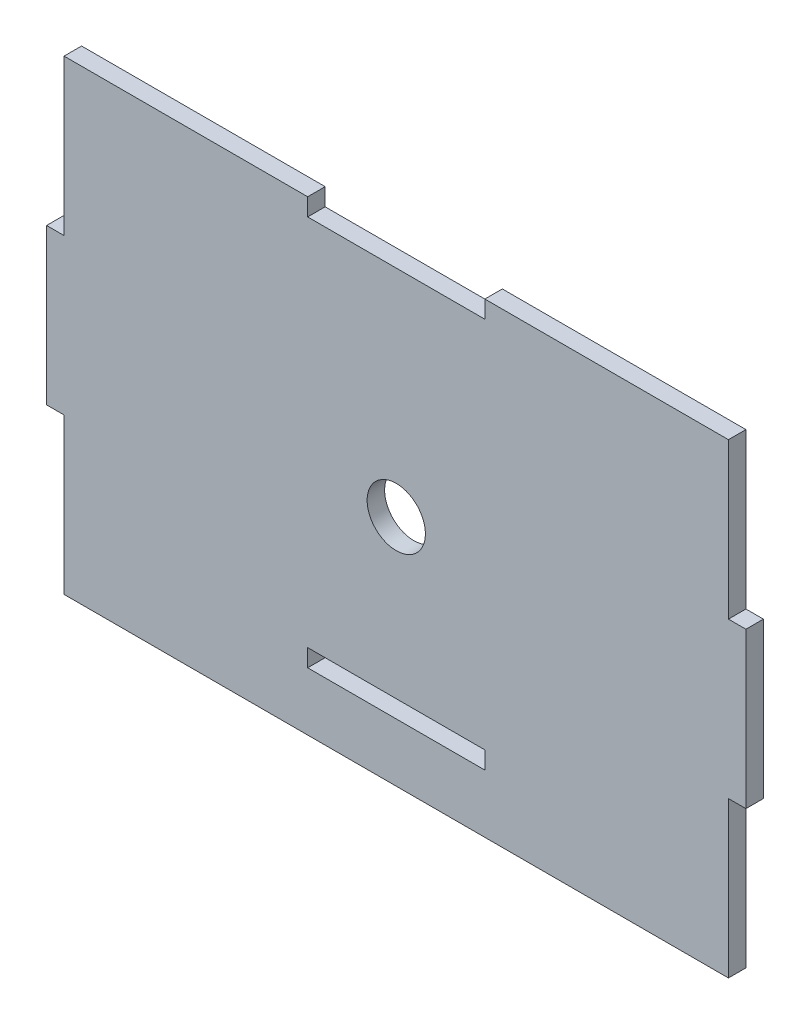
SolidWorks part; units mm, degrees
ref_plane "Front Plane" through (0, 0, 0) normal (0, 0, 1) x (1, 0, 0)
ref_plane "Top Plane" through (0, 0, 0) normal (0, 1, 0) x (1, 0, 0)
ref_plane "Right Plane" through (0, 0, 0) normal (1, 0, 0) x (0, 0, -1)
sketch "Sketch1" plane through (0, 0, 0) normal (0, 0, 1) x (1, 0, 0)
  line L1 (-60, -40) -> (60, -40)
  line L2 (-60, -40) -> (-60, 40)
  line L3 (-60, 40) -> (60, 40)
  line L4 (60, -40) -> (60, 40)
  line L5 (-60, -40) -> (60, 40) construction
  line L6 (-60, 40) -> (60, -40) construction
  point P0 (0, 0)
  dimension "D1" = 120
  dimension "D2" = 80
extrude "Boss-Extrude1" add sketch "Sketch1" along normal blind 3
sketch "Sketch2" plane through (0, 0, 3) normal (0, 0, 1) x (1, 0, 0)
  line L0 (-60, -30) -> (60, -30)
  line L1 (-60, -30) -> (-60, -27)
  line L2 (60, -30) -> (60, -27)
  line L3 (-60, -27) -> (60, -27)
  line L4 (-60, 40) -> (-60, -40) construction
  line L5 (60, -40) -> (60, 40) construction
  line L6 (-60, -40) -> (60, -40) construction
  line L7 (-15.2, -27) -> (-15.2, -30)
  line L8 (-15.2, -27) -> (15.2, -27)
  line L9 (-15.2, -30) -> (15.2, -30)
  line L10 (15.2, -27) -> (15.2, -30)
  line L11 (-15, -30) -> (-15, -27) construction
  line L12 (15, -30) -> (15, -27) construction
  dimension "D1" = 10
  dimension "D2" = 3
  dimension "D3" = 0.2
  dimension "D4" = 0.2
extrude "Cut-Extrude1" cut sketch "Sketch2" against normal blind 3 contours L10 L3 L7 L0
sketch "Sketch3" plane through (0, 0, 3) normal (0, 0, 1) x (1, 0, 0)
  line L0 (-60, -40) -> (60, -40) construction
  line L1 (-60, 40) -> (-57, 40)
  line L2 (-60, 40) -> (-60, 13.3333)
  line L3 (-60, 13.3333) -> (-57, 13.3333)
  line L4 (-57, 40) -> (-57, 13.3333)
  line L5 (-60, 13.3333) -> (-57, 13.3333)
  line L6 (-60, 13.3333) -> (-60, -13.3333)
  line L7 (-60, -13.3333) -> (-57, -13.3333)
  line L8 (-57, 13.3333) -> (-57, -13.3333)
  line L9 (-60, -13.3333) -> (-57, -13.3333)
  line L10 (-60, -13.3333) -> (-60, -40)
  line L11 (-60, -40) -> (-57, -40)
  line L12 (-57, -13.3333) -> (-57, -40)
  dimension "D1" = 3
extrude "Cut-Extrude2" cut sketch "Sketch3" against normal blind 3 contours L4 L3 M14 M15 | L12 L7 M15 M16
mirror "Mirror1" about plane through (0, 0, 0) normal (1, 0, 0) of "Cut-Extrude2"
pattern_linear "LPattern1" count 2 spacing 67 along (0, 1, 0) of "Cut-Extrude1"
sketch "Sketch4" plane through (0, 0, 3) normal (0, 0, 1) x (1, 0, 0)
  circle A0 centre (0, 0) radius 5
  dimension "D1" = 10
extrude "Cut-Extrude3" cut sketch "Sketch4" against normal blind 10
